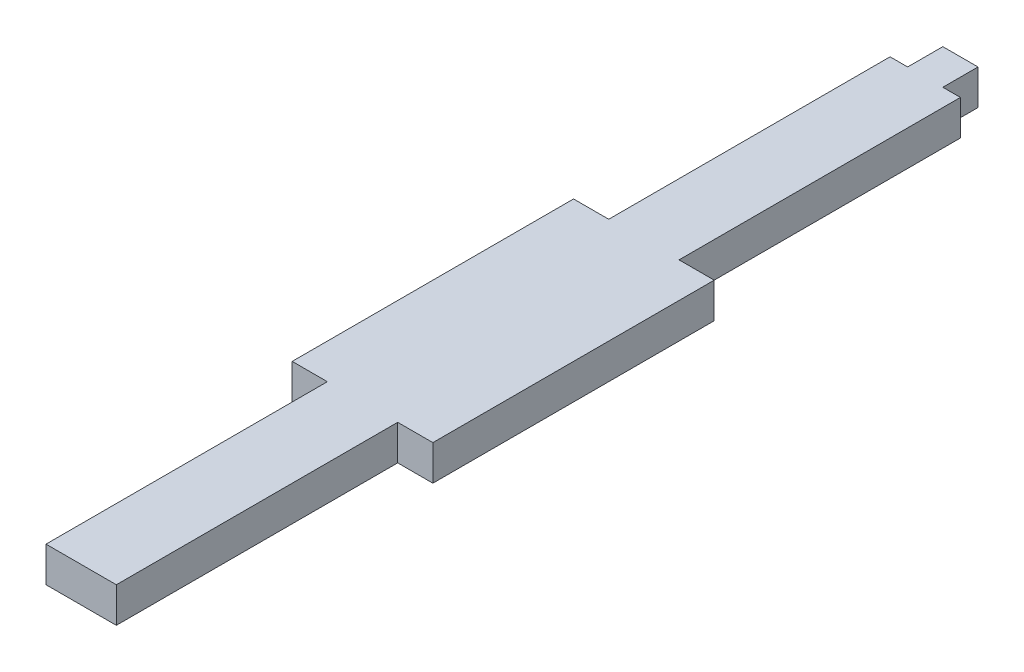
SolidWorks part; units mm, degrees
ref_plane "Front Plane" through (0, 0, 0) normal (0, 0, 1) x (1, 0, 0)
ref_plane "Top Plane" through (0, 0, 0) normal (0, 1, 0) x (1, 0, 0)
ref_plane "Right Plane" through (0, 0, 0) normal (1, 0, 0) x (0, 0, -1)
sketch "Sketch1" plane through (0, 0, 0) normal (0, 1, 0) x (1, 0, 0)
  line L0 (6.35, -53.975) -> (6.35, -28.575)
  line L1 (3.175, -79.375) -> (-3.175, -79.375)
  line L2 (3.175, -79.375) -> (3.175, -53.975)
  line L3 (-6.35, -28.575) -> (-3.175, -28.575)
  line L4 (-3.175, -79.375) -> (-3.175, -53.975)
  line L5 (3.175, -79.375) -> (-2.921, -3.175) construction
  line L6 (2.921, -3.175) -> (-3.175, -79.375) construction
  line L7 (0, 0) -> (-1.5875, 0)
  line L8 (-3.175, -3.175) -> (-3.175, -28.575)
  line L9 (0, 0) -> (1.5875, 0)
  line L10 (6.35, -28.575) -> (3.175, -28.575)
  line L11 (-1.5875, 0) -> (-1.5875, -3.175)
  line L12 (3.175, -3.175) -> (3.175, -28.575)
  line L13 (1.5875, 0) -> (1.5875, -3.175)
  line L14 (6.35, -53.975) -> (3.175, -53.975)
  line L15 (-6.35, -53.975) -> (-6.35, -28.575)
  line L16 (1.5875, -3.175) -> (3.175, -3.175)
  line L17 (-3.175, -3.175) -> (-1.5875, -3.175)
  line L19 (-6.35, -53.975) -> (-3.175, -53.975)
  point P0 (0, -39.6875)
extrude "Boss-Extrude1" add sketch "Sketch1" along normal blind 3.175
